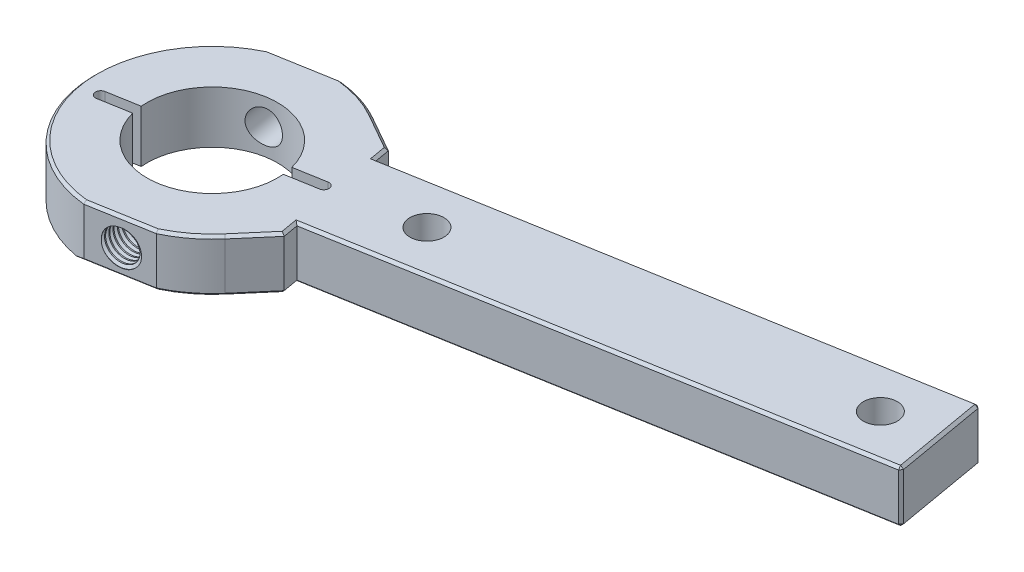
SolidWorks part; units mm, degrees
ref_plane "Front Plane" through (0, 0, 0) normal (0, 0, 1) x (1, 0, 0)
ref_plane "Top Plane" through (0, 0, 0) normal (0, 1, 0) x (1, 0, 0)
ref_plane "Right Plane" through (0, 0, 0) normal (1, 0, 0) x (0, 0, -1)
sketch "Sketch1" plane through (0, 0, 0) normal (0, 1, 0) x (1, 0, 0)
  line L0 (0, 0) -> (-172.397, -30.071) construction
  line L1 (0, 0) -> (118.7182, 20.7079) construction
  line L2 (-230.6742, -135) -> (119.6327, -135) construction
  line L3 (18.6161, 12.6369) -> (117.1287, 29.8203)
  line L4 (-5, 9.2331) -> (5, 9.2331) construction
  line L5 (-5, 9.2331) -> (-5, -9.2331) construction
  line L6 (-5, -9.2331) -> (5, -9.2331) construction
  line L7 (5, 9.2331) -> (5, -9.2331) construction
  line L8 (-5, 9.2331) -> (5, -9.2331) construction
  line L9 (-5, -9.2331) -> (5, 9.2331) construction
  line L10 (117.1287, 29.8203) -> (120.3076, 11.5955)
  line L11 (120.3076, 11.5955) -> (21.7951, -5.588)
  line L17 (-138.5641, -80) -> (-87.5752, -20.9735) construction
  line L18 (18.6161, 12.6369) -> (18.1006, 15.5922)
  line L19 (21.7951, -5.588) -> (22.3106, -8.5434)
  line L21 (17.0844, -14.6415) -> (22.3106, -8.5434)
  line L22 (-134.5822, -10.7605) -> (-58.9335, -76.1081) construction
  line L23 (-9.637, 20.3317) -> (2.1845, 22.3937)
  line L24 (-3.7263, 21.3627) -> (0, 0) construction
  line L25 (0, 0) -> (3.7263, -21.3627) construction
  line L26 (-2.1845, -22.3937) -> (9.637, -20.3317)
  line L27 (18.1006, 15.5922) -> (11.1185, 19.5609)
  line L28 (12.1028, 3.1262) -> (18.0135, 4.1572)
  line L29 (-18.3572, -2.1869) -> (-12.4464, -1.1559)
  line L30 (12.4464, 1.1559) -> (18.3572, 2.1869)
  line L32 (-18.0135, -4.1572) -> (-12.1028, -3.1262)
  circle A0 centre (0, 0) radius 12.5 construction
  circle A1 centre (-138.5641, -80) radius 55 construction
  circle A2 centre (0, 0) radius 10.5 construction
  circle A7 centre (108.8669, 18.9895) radius 3.25
  circle A8 centre (34.9825, 6.102) radius 3.25
  circle A11 centre (0, 0) radius 22.5 construction
  arc A12 (11.1185, 19.5609) -> (2.1845, 22.3937) centre (0, 0) ccw
  arc A13 (17.0844, -14.6415) -> (9.637, -20.3317) centre (0, 0) cw
  arc A16 (-12.4464, -1.1559) -> (12.1028, 3.1262) centre (0, 0) cw
  arc A17 (-12.1028, -3.1262) -> (12.4464, 1.1559) centre (0, 0) ccw
  arc A18 (-9.637, 20.3317) -> (-2.1845, -22.3937) centre (0, 0) ccw
  arc A19 (-18.3572, -2.1869) -> (-18.0135, -4.1572) centre (-18.1854, -3.1721) ccw
  arc A20 (18.0135, 4.1572) -> (18.3572, 2.1869) centre (18.1854, 3.1721) cw
  point P14 (0, 0)
  point P21 (118.7182, 20.7079)
  point P45 (3.7263, -21.3627)
  dimension "D1" = 110
  dimension "D2" = 25
  dimension "D4" = 2
  dimension "D9" = 10
  dimension "D11" = 6.5
  dimension "D15" = 6
  dimension "D8" = 22.5
  dimension "D22" = 2
  dimension "D3" = 135
  dimension "D5" = 10
  dimension "D6" = 18.4662
  dimension "D7" = 18.5
  dimension "D10" = 160
  dimension "D12" = 10
  dimension "D13" = 75
  dimension "D14" = 100
  dimension "D19" = 175
  dimension "D20" = 3
  dimension "D23" = 12
  dimension "D24" = 2
extrude "Boss-Extrude1" add sketch "Sketch1" along normal mid plane 10
sketch "Sketch2" plane through (-3.7263, 0, -21.3627) normal (-0.1718, 0, -0.9851) x (-0.9851, 0, 0.1718)
  line L4 (-6, -5) -> (6, -5)
  line L5 (6, -5) -> (6, 5)
  line L6 (6, 5) -> (-6, 5)
  line L7 (-6, 5) -> (-6, -5)
  line L8 (-6, -5) -> (6, -5) construction
  line L10 (6, 5) -> (-6, 5) construction
  line L11 (-6, 5) -> (-6, -5) construction
  line L12 (6, -5) -> (6, 5)
  circle A0 centre (0, 0) radius 3.1
  dimension "D2" = 6.2
  dimension "D1" = 0
extrude "Cut-Extrude1" cut sketch "Sketch2" against normal through all contours A0
chamfer "Chamfer1" distance 0.5 angle 45 25 edges at (19.6975, -5, 11.5924) (13.6603, -5, 17.8787) (3.7263, -5, 21.3627) (-3.7263, -5, -21.3627) (6.8006, -5, -21.4476) (67.8724, 5, -21.2286) (118.7182, 5, -20.7079) (18.3584, 5, -14.1145) (14.6096, 5, -17.5766) (6.8006, 5, -21.4476) (-3.7263, 5, -21.3627) (3.7263, 5, 21.3627) (13.6603, 5, 17.8787) (19.6975, 5, 11.5924) (22.0528, 5, 7.0657) (71.0513, 5, -3.0037) (117.1287, 0, -29.8203) (120.3076, 0, -11.5955) (22.0528, -5, 7.0657) (71.0513, -5, -3.0037) (118.7182, -5, -20.7079) (14.6096, -5, -17.5766) (18.3584, -5, -14.1145) (67.8724, -5, -21.2286) (-22.1653, 5, 3.8663)
thread "Thread1" pitch 1 start angle 0, offset 2, length 12, pitch 1, diameter 6.2
ref_plane "Plane1" through (1.016, 0, 23.8656) normal (0, -1, 0) x (-0.9851, 0, 0.1718)
sketch "Thread Profile1" plane through (1.016, 0, 23.8656) normal (0, -1, 0) x (-0.9851, 0, 0.1718)
  line L0 (0, 0) -> (0, 1) construction
  line L1 (0, 0) -> (0.5413, 0.3125)
  line L2 (0.5413, 0.3125) -> (0.5413, 0.4375)
  line L3 (0.5413, 0.4375) -> (0, 0.75)
  line L4 (0.5413, 0.375) -> (0, 0.375) construction
  line L11 (0, 0) -> (0, 0.75)
  point P2 (0, 0)
  dimension "Pitch" = 1
  dimension "Profile_Angle" = 60
  dimension "Profile_Land" = 0.125
  dimension "Profile_Height" = 0.5413
